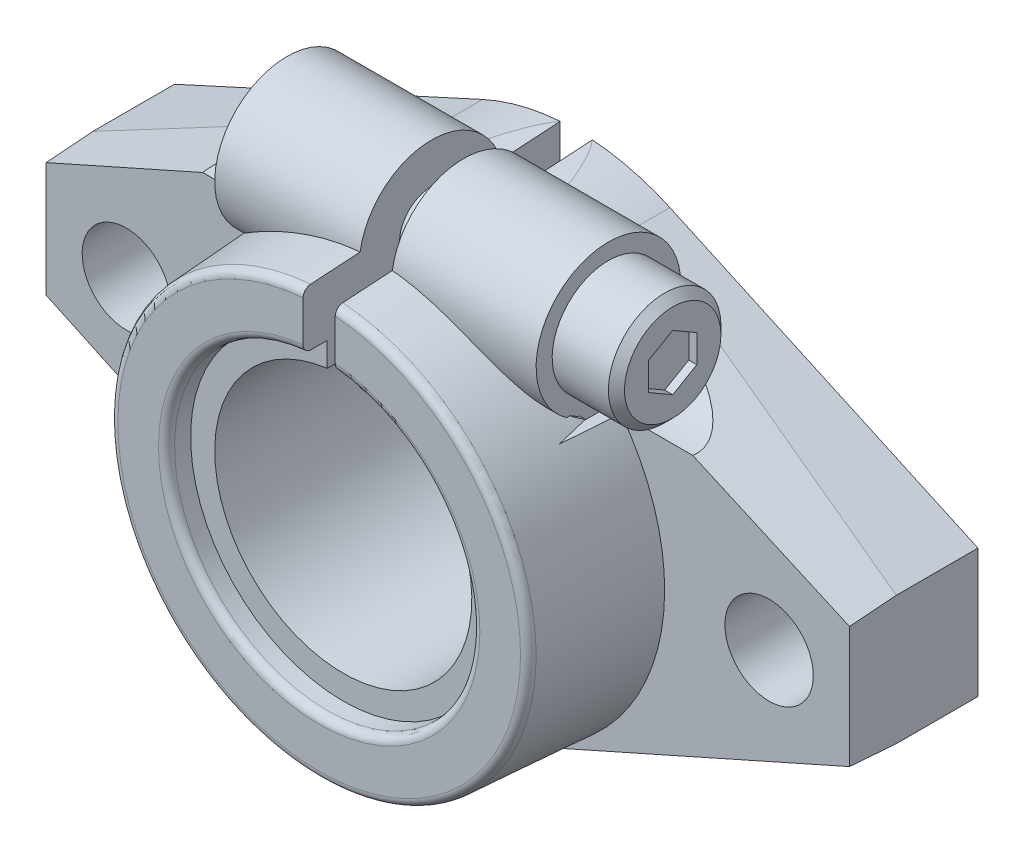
SolidWorks part; units mm, degrees
other "Solid1"
ref_plane "Front Plane" through (0, 0, 0) normal (0, 0, 1) x (1, 0, 0)
ref_plane "Top Plane" through (0, 0, 0) normal (0, 1, 0) x (1, 0, 0)
ref_plane "Right Plane" through (0, 0, 0) normal (1, 0, 0) x (0, 0, -1)
imported_body "2.7122 SHF16.stp<1>"
fillet "Fillet1" radius 0.5
